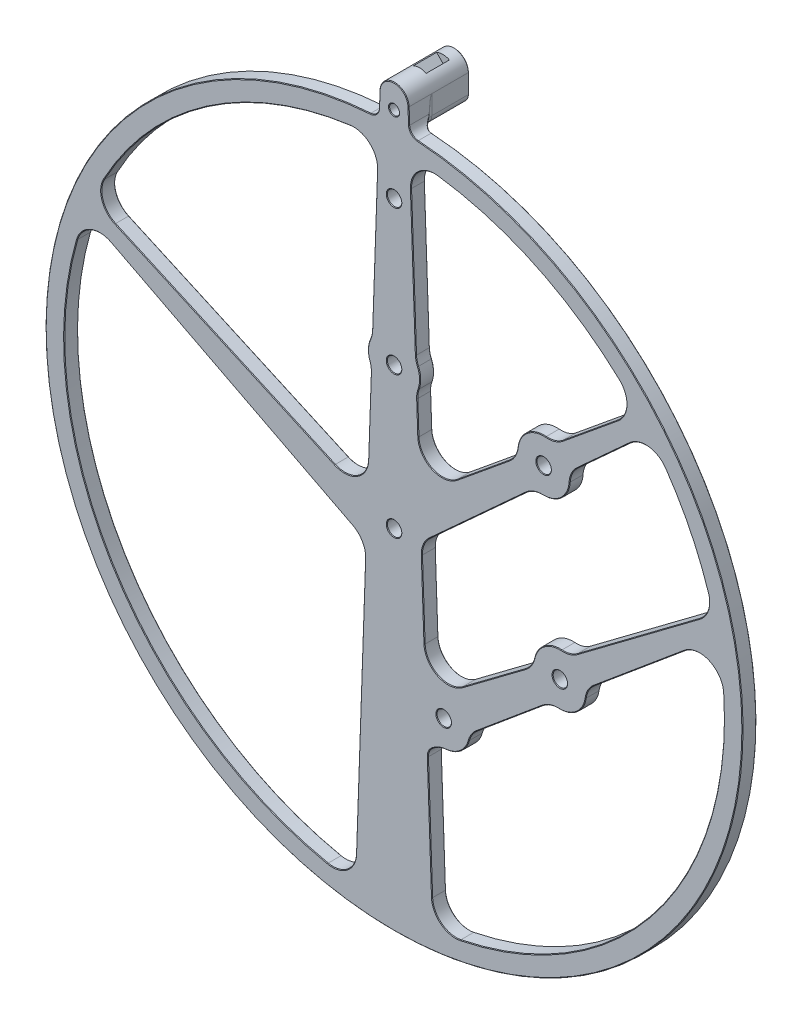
SolidWorks part; units mm, degrees
ref_plane "Спереди" through (0, 0, 0) normal (0, 0, 1) x (1, 0, 0)
ref_plane "Сверху" through (0, 0, 0) normal (0, 1, 0) x (1, 0, 0)
ref_plane "Справа" through (0, 0, 0) normal (1, 0, 0) x (0, 0, -1)
sketch "Эскиз1" plane through (0, 0, 0) normal (0, 0, 1) x (1, 0, 0)
  line L0 (0, 186.4729) -> (0, -150) construction
  line L1 (-16.3751, -129.4979) -> (-12.4529, -17.1836)
  line L2 (16.3751, -129.4979) -> (14.5719, -77.8624)
  line L3 (0, -76.9749) -> (145.1349, 37.8927) construction
  line L4 (131.591, 32.2745) -> (78.8549, -7.2633)
  line L5 (125.016, 16.8683) -> (86.0498, -15.6663)
  line L6 (131.591, 32.2745) -> (144.5236, 42.5101) construction
  line L7 (125.016, 16.8683) -> (148.2452, 35.2532) construction
  line L8 (56.5522, -23.9843) -> (29.3788, -44.357)
  line L9 (63.9818, -34.0918) -> (35.5262, -57.8507)
  line L10 (16.6684, -73.5959) -> (16.3643, -73.8498)
  line L11 (13.1304, -36.5825) -> (11.9911, -3.957)
  line L12 (6.4925, 153.5027) -> (6.2562, 160.2685)
  line L13 (-6.4925, 153.5027) -> (-6.2562, 160.2685)
  line L14 (-9.4332, 69.2905) -> (-7.3018, 130.3247)
  line L15 (9.4332, 69.2905) -> (7.3018, 130.3247)
  line L16 (0, 0) -> (113.4466, 98.1319) construction
  line L17 (27.0773, 31.8104) -> (49.5494, 50.2429)
  line L18 (15.2992, 3.905) -> (56.8548, 41.7974)
  line L19 (10.4801, 39.3113) -> (9.9885, 53.3878)
  line L20 (72.6219, 69.1679) -> (96.3175, 88.604)
  line L21 (78.9053, 61.904) -> (101.5512, 82.5535)
  line L22 (96.3175, 88.604) -> (114.4037, 104.2487) construction
  line L23 (101.5512, 82.5535) -> (118.1278, 96.8925) construction
  line L24 (0, -8.6) -> (-138.3416, 57.9793) construction
  line L25 (-25.4723, 11.1102) -> (-120.0439, 53.6123)
  line L26 (-17.9626, -7.7925) -> (-122.0022, 45.6766)
  line L27 (-11.1537, 20.0228) -> (-9.9885, 53.3878)
  line L28 (-122.0022, 45.6766) -> (-146.1883, 57.3165) construction
  line L29 (-120.0439, 53.6123) -> (-142.9642, 64.6432) construction
  arc A0 (-10.2175, 149.6516) -> (10.2175, 149.6516) centre (0, 0) ccw
  arc A1 (135.1675, 43.5172) -> (116.7502, 80.8293) centre (0, 0) ccw
  circle A2 centre (0, 0) radius 3.1
  circle A3 centre (0, 61) radius 3.1
  circle A4 centre (0, 123.05) radius 3.1
  circle A5 centre (0, 156.05) radius 2.15
  arc A6 (6.2562, 160.2685) -> (-6.2562, 160.2685) centre (0, 160.05) ccw
  circle A7 centre (0, 0) radius 63.75 construction
  circle A8 centre (21.37, -60.0615) radius 3.1
  circle A9 centre (71.3581, -20.4982) radius 3.1
  arc A10 (72.0949, -9.2724) -> (60.3758, -18.0585) centre (71.3581, -20.4982) ccw
  arc A11 (70.9038, -31.7391) -> (82.4995, -22.0572) centre (71.3581, -20.4982) ccw
  circle A12 centre (0, 0) radius 142 construction
  arc A13 (125.016, 16.8683) -> (141.6636, 9.7683) centre (131.5277, 9.0694) cw
  arc A14 (131.591, 32.2745) -> (135.1675, 43.5172) centre (125.4964, 40.4036) ccw
  arc A15 (22.3211, -71.2712) -> (32.23, -62.9978) centre (21.37, -60.0615) ccw
  arc A16 (13.1304, -36.5825) -> (29.3788, -44.357) centre (23.2842, -36.228) ccw
  arc A17 (22.3211, -71.2712) -> (16.6684, -73.5959) centre (23.18, -81.3949) ccw
  arc A18 (35.5262, -57.8507) -> (32.23, -62.9978) centre (42.0379, -65.6496) ccw
  arc A19 (56.5522, -23.9843) -> (60.3758, -18.0585) centre (50.4576, -15.8552) ccw
  arc A20 (63.9818, -34.0918) -> (70.9038, -31.7391) centre (70.4935, -41.8908) cw
  arc A21 (86.0498, -15.6663) -> (82.4995, -22.0572) centre (92.5615, -23.4652) ccw
  arc A22 (78.8549, -7.2633) -> (72.0949, -9.2724) centre (72.7603, 0.8658) cw
  arc A23 (14.5719, -77.8624) -> (16.3643, -73.8498) centre (19.5689, -77.6879) cw
  arc A24 (28.5733, -139.0955) -> (141.6636, 9.7683) centre (0, 0) ccw
  arc A25 (28.5733, -139.0955) -> (16.3751, -129.4979) centre (26.5289, -129.1434) cw
  arc A26 (-28.5733, -139.0955) -> (-16.3751, -129.4979) centre (-26.5289, -129.1434) ccw
  circle A27 centre (0, 0) radius 150 construction
  arc A28 (-18.8008, 140.7499) -> (-124.8091, 67.7252) centre (0, 0) ccw
  arc A29 (-10.2921, 65.5426) -> (-10.5839, 57.1864) centre (0, 61) ccw
  arc A30 (10.5839, 57.1864) -> (10.2921, 65.5426) centre (0, 61) ccw
  arc A31 (9.4332, 69.2905) -> (10.2921, 65.5426) centre (19.587, 69.645) ccw
  arc A32 (9.9885, 53.3878) -> (10.5839, 57.1864) centre (20.1424, 53.7423) cw
  arc A33 (-9.9885, 53.3878) -> (-10.5839, 57.1864) centre (-20.1424, 53.7423) ccw
  arc A34 (-9.4332, 69.2905) -> (-10.2921, 65.5426) centre (-19.587, 69.645) cw
  circle A35 centre (64.38, 55.6891) radius 3.1
  arc A36 (64.023, 44.4447) -> (75.6095, 55.0099) centre (64.38, 55.6891) ccw
  arc A37 (65.325, 66.8993) -> (53.2015, 56.9551) centre (64.38, 55.6891) ccw
  arc A38 (96.8001, 103.893) -> (18.8008, 140.7499) centre (0, 0) ccw
  arc A39 (116.7502, 80.8293) -> (101.5512, 82.5535) centre (108.3968, 75.046) ccw
  arc A40 (96.3175, 88.604) -> (96.8001, 103.893) centre (89.8741, 96.4595) ccw
  arc A41 (27.0773, 31.8104) -> (10.4801, 39.3113) centre (20.6339, 39.6659) cw
  arc A42 (15.2992, 3.905) -> (11.9911, -3.957) centre (22.1449, -3.6025) ccw
  arc A43 (49.5494, 50.2429) -> (53.2015, 56.9551) centre (43.106, 58.0984) ccw
  arc A44 (64.023, 44.4447) -> (56.8548, 41.7974) centre (63.7005, 34.2899) ccw
  arc A45 (78.9053, 61.904) -> (75.6095, 55.0099) centre (85.7509, 54.3965) ccw
  arc A46 (72.6219, 69.1679) -> (65.325, 66.8993) centre (66.1785, 77.0234) cw
  arc A47 (7.3018, 130.3247) -> (18.8008, 140.7499) centre (17.4557, 130.6793) cw
  arc A48 (-18.8008, 140.7499) -> (-7.3018, 130.3247) centre (-17.4557, 130.6793) cw
  arc A49 (10.2175, 149.6516) -> (6.4925, 153.5027) centre (10.49, 153.6423) cw
  arc A50 (-10.2175, 149.6516) -> (-6.4925, 153.5027) centre (-10.49, 153.6423) ccw
  arc A51 (-136.4061, 39.4637) -> (-28.5733, -139.0955) centre (0, 0) ccw
  arc A52 (-120.0439, 53.6123) -> (-124.8091, 67.7252) centre (-115.8791, 62.8795) cw
  arc A53 (-122.0022, 45.6766) -> (-136.4061, 39.4637) centre (-126.6463, 36.6401) ccw
  arc A54 (-17.9626, -7.7925) -> (-12.4529, -17.1836) centre (-22.6068, -16.829) cw
  arc A55 (-11.1537, 20.0228) -> (-25.4723, 11.1102) centre (-21.3075, 20.3773) cw
  point P47 (19.5766, -71.1677)
  point P53 (67.5738, -31.0927)
  point P76 (9.9087, 55.6728)
  point P96 (104.9334, 95.6712)
  point P101 (11.1969, 18.7847)
  point P112 (68.8011, 66.034)
  point P119 (6.6199, 149.8539)
  point P122 (-6.6199, 149.8539)
  point P133 (-132.4982, 51.0708)
  dimension "D1" = 300
  dimension "D2" = 8
  dimension "D3" = 6.2
  dimension "D6" = 4.3
  dimension "D8" = 12.52
  dimension "D12" = 127.5
  dimension "D15" = 22.5
  dimension "D17" = 10.16
  dimension "D22" = 10.16
  dimension "D23" = 10.16
  dimension "D24" = 5
  dimension "D26" = 10.16
  dimension "D28" = 10.16
  dimension "D32" = 10.16
  dimension "D36" = 10.16
  dimension "D37" = 10.16
  dimension "D38" = 10.16
  dimension "D39" = 4
  dimension "D44" = 10.16
  dimension "D47" = 10.16
  dimension "D4" = 61
  dimension "D5" = 62.05
  dimension "D7" = 156.05
  dimension "D9" = 4
  dimension "D10" = 4
  dimension "D11" = 51.64
  dimension "D13" = 21.37
  dimension "D14" = 63.75
  dimension "D16" = 3
  dimension "D18" = 8
  dimension "D19" = 4
  dimension "D20" = 1.5
  dimension "D21" = 2
  dimension "D25" = 2
  dimension "D27" = 32.7501
  dimension "D29" = 64.38
  dimension "D30" = 49.14
  dimension "D31" = 3
  dimension "D33" = 1.5
  dimension "D34" = 8
  dimension "D35" = 4
  dimension "D40" = 64.3
  dimension "D41" = 8.6
  dimension "D42" = 1.5
  dimension "D43" = 3
  dimension "D45" = 4
  dimension "D46" = 8
extrude "Бобышка-Вытянуть1" add sketch "Эскиз1" along normal blind 6
sketch "Эскиз2" plane through (0, 0, 0) normal (0, 0, -1) x (-1, 0, 0)
  line L0 (-6.2562, 160.2685) -> (-6.2562, 152.05)
  line L1 (6.2562, 160.2685) -> (6.2562, 152.05)
  line L2 (-2.2562, 148.05) -> (2.2562, 148.05)
  circle A0 centre (0, 156.05) radius 2.15 construction
  circle A1 centre (0, 156.05) radius 2.15
  arc A2 (6.2562, 160.2685) -> (-6.2562, 160.2685) centre (0, 160.05) ccw construction
  arc A3 (6.2562, 160.2685) -> (-6.2562, 160.2685) centre (0, 160.05) ccw
  arc A4 (6.2562, 152.05) -> (2.2562, 148.05) centre (2.2562, 152.05) cw
  arc A5 (-6.2562, 152.05) -> (-2.2562, 148.05) centre (-2.2562, 152.05) ccw
  dimension "D2" = 4
  dimension "D1" = 8
extrude "Бобышка-Вытянуть2" add sketch "Эскиз2" along normal blind 20
fillet "Скругление1" radius 4 5 edges at (6.2562, 156.1592, 0) (-6.2562, 156.1592, 0) (-5.0846, 149.2216, 0) (0, 148.05, 0) (5.0846, 149.2216, 0)
ref_plane "Плоскость1" through (0, 0, -15) normal (0, 0, -1) x (-1, 0, 0)
sketch "Эскиз3" plane through (0, 0, -15) normal (0, 0, -1) x (-1, 0, 0)
  line L0 (-3.5159, 166.31) -> (3.2641, 166.31)
  line L1 (3.2641, 166.31) -> (-0.1259, 162.92)
  line L2 (-0.1259, 162.92) -> (-3.5159, 166.31)
  line L3 (0, 156.05) -> (-0.1259, 166.31) construction
  arc A0 (6.2562, 160.2685) -> (-6.2562, 160.2685) centre (0, 160.05) ccw construction
  dimension "D1" = 90
  dimension "D2" = 3.39
extrude "Вырез-Вытянуть1" cut sketch "Эскиз3" against normal blind 10
chamfer "Фаска1" distance 0.25 angle 45 156 edges at (67.48, 55.6891, 6) (10.1049, 55.3155, 6) (10.2343, 46.3495, 6) (16.4497, 30.4075, 6) (38.3133, 41.0267, 6) (52.0305, 53.2426, 6) (57.2454, 64.3873, 6) (69.1949, 67.3215, 6) (84.4697, 78.886, 6) (100.029, 96.1389, 6) (60.6671, 128.3881, 6) (10.6315, 138.2064, 6) (8.3675, 99.8076, 6) (9.6837, 67.3755, 6) (11.2431, 61.3926, 6) (58.9946, -21.3638, 6) (64.6096, -11.4971, 6) (75.6548, -8.8732, 6) (105.2229, 12.5056, 6) (135.1783, 37.3236, 6) (127.333, 62.8515, 6) (109.5421, 85.1413, 6) (90.2282, 72.2287, 6) (76.5845, 58.7786, 6) (71.9601, 47.3762, 6) (60.1805, 43.8206, 6) (36.077, 22.8512, 6) (12.7801, 0.338, 6) (12.5607, -20.2698, 6) (18.899, -45.3929, 6) (42.9655, -34.1706, 6) (24.47, -60.0615, 6) (3.1, 123.05, 6) (3.1, 0, 6) (6.3743, 156.8856, 6) (7.6149, 150.8613, 6) (0, -150, 6) (-7.6149, 150.8613, 6) (-6.3743, 156.8856, 6) (0, 166.31, 6) (83.6799, -18.5313, 6) (78.5684, -29.1339, 6) (67.2238, -32.2713, 6) (49.754, -45.9712, 6) (33.4819, -60.1705, 6) (28.5803, -68.6972, 6) (19.3158, -71.9984, 6) (16.5163, -73.7229, 6) (15.0036, -75.6486, 6) (15.4735, -103.6801, 6) (20.2464, -137.1281, 6) (113.0719, -85.8996, 6) (135.5135, 18.4149, 6) (105.5329, 0.601, 6) (3.1, 61, 6) (2.15, 156.05, 6) (74.4581, -20.4982, 6) (-14.414, -73.3407, 6) (-13.8436, -11.6877, 6) (-69.9824, 18.942, 6) (-130.6703, 45.9693, 6) (-121.5541, -73.4071, 6) (-20.2464, -137.1281, 6) (-9.6837, 67.3755, 6) (-8.3675, 99.8076, 6) (-10.6315, 138.2064, 6) (-80.555, 116.9397, 6) (-125.5051, 59.6292, 6) (-72.7581, 32.3613, 6) (-15.9386, 11.7518, 6) (-10.5711, 36.7053, 6) (-10.1049, 55.3155, 6) (-11.2431, 61.3926, 6) (6.2562, 160.2685, -12) (-6.2562, 160.2685, -12) (6.3157, 158.5644, -3.3126) (-6.3157, 158.5644, -3.3126) (6.5768, 152.8138, -2.431) (-6.5688, 152.8522, -2.4497) (8.0828, 150.4477, -0.5115) (-8.5788, 150.1285, -0.25) (10.0579, 149.6657, 0) (0, -150, 0) (-10.0579, 149.6657, 0) (-10.5711, 36.7053, 0) (-15.9386, 11.7518, 0) (-72.7581, 32.3613, 0) (-125.5051, 59.6292, 0) (-80.555, 116.9397, 0) (-10.6315, 138.2064, 0) (-8.3675, 99.8076, 0) (-9.6837, 67.3755, 0) (-11.2431, 61.3926, 0) (-10.1049, 55.3155, 0) (-130.6703, 45.9693, 0) (-69.9824, 18.942, 0) (-13.8436, -11.6877, 0) (-14.414, -73.3407, 0) (-20.2464, -137.1281, 0) (-121.5541, -73.4071, 0) (74.4581, -20.4982, 0) (3.1, 61, 0) (113.0719, -85.8996, 0) (20.2464, -137.1281, 0) (15.4735, -103.6801, 0) (15.0036, -75.6486, 0) (16.5163, -73.7229, 0) (19.3158, -71.9984, 0) (28.5803, -68.6972, 0) (33.4819, -60.1705, 0) (49.754, -45.9712, 0) (67.2238, -32.2713, 0) (78.5684, -29.1339, 0) (83.6799, -18.5313, 0) (105.5329, 0.601, 0) (135.5135, 18.4149, 0) (3.1, 0, 0) (3.1, 123.05, 0) (24.47, -60.0615, 0) (12.5607, -20.2698, 0) (12.7801, 0.338, 0) (36.077, 22.8512, 0) (60.1805, 43.8206, 0) (71.9601, 47.3762, 0) (76.5845, 58.7786, 0) (90.2282, 72.2287, 0) (109.5421, 85.1413, 0) (127.333, 62.8515, 0) (135.1783, 37.3236, 0) (105.2229, 12.5056, 0) (75.6548, -8.8732, 0) (64.6096, -11.4971, 0) (58.9946, -21.3638, 0) (42.9655, -34.1706, 0) (18.899, -45.3929, 0) (8.3675, 99.8076, 0) (10.6315, 138.2064, 0) (60.6671, 128.3881, 0) (100.029, 96.1389, 0) (84.4697, 78.886, 0) (69.1949, 67.3215, 0) (57.2454, 64.3873, 0) (52.0305, 53.2426, 0) (38.3133, 41.0267, 0) (16.4497, 30.4075, 0) (10.2343, 46.3495, 0) (10.1049, 55.3155, 0) (11.2431, 61.3926, 0) (9.6837, 67.3755, 0) (67.48, 55.6891, 0) (-6.2562, 156.1592, -20) (-5.0846, 149.2216, -20) (0, 148.05, -20) (5.0846, 149.2216, -20) (6.2562, 156.1592, -20) (0, 166.31, -20)
chamfer "Фаска2" distance 1.66 angle 45 1 edges at (-2.15, 156.05, -20)
